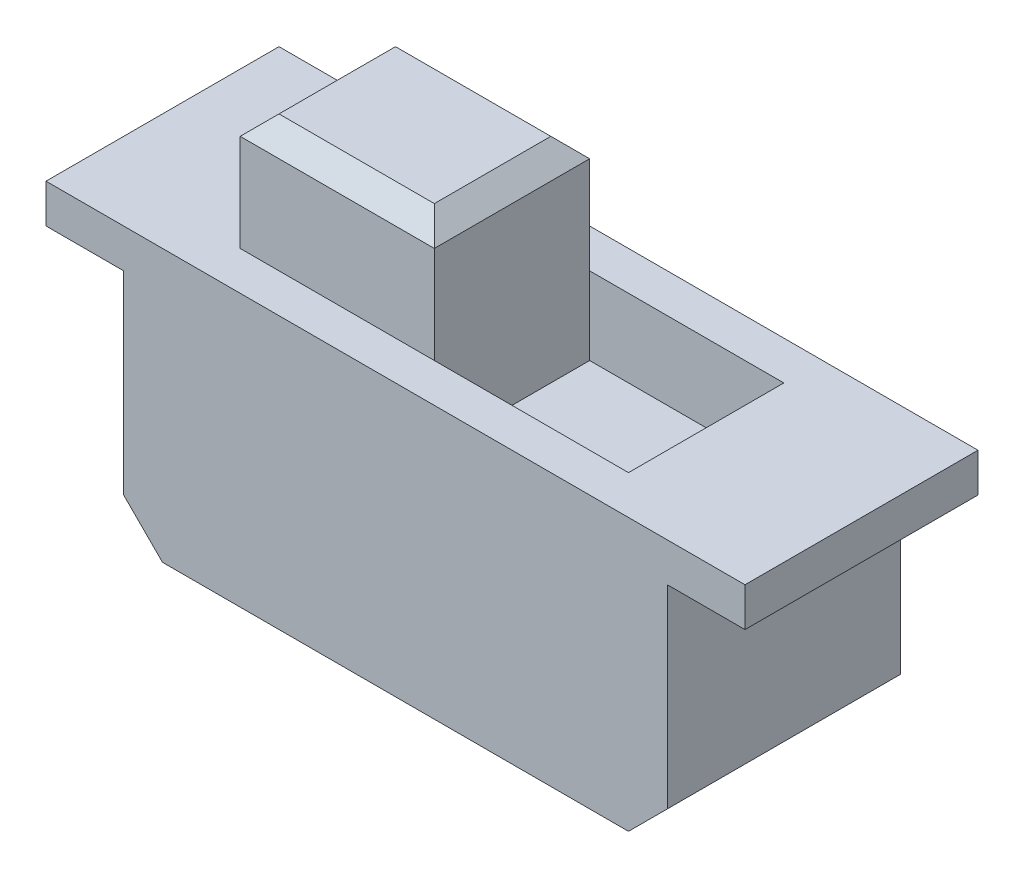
SolidWorks part; units mm, degrees
ref_plane "Plan de face" through (0, 0, 0) normal (0, 0, 1) x (1, 0, 0)
ref_plane "Plan de dessus" through (0, 0, 0) normal (0, 1, 0) x (1, 0, 0)
ref_plane "Plan de droite" through (0, 0, 0) normal (1, 0, 0) x (0, 0, -1)
sketch "Esquisse1" plane through (0, 0, 0) normal (0, 0, 1) x (1, 0, 0)
  line L0 (-9, 0) -> (9, 0)
  line L1 (9, 0) -> (9, -1)
  line L2 (9, -1) -> (7, -1)
  line L3 (7, -1) -> (7, -6)
  line L4 (7, -6) -> (6, -7)
  line L5 (6, -7) -> (-6, -7)
  line L6 (-6, -7) -> (-7, -6)
  line L7 (-7, -6) -> (-7, -1)
  line L8 (-7, -1) -> (-9, -1)
  line L9 (-9, -1) -> (-9, 0)
  dimension "D1" = 12
  dimension "D2" = 5
  dimension "D3" = 1
  dimension "D4" = 2
  dimension "D5" = 18
  dimension "D6" = 45
extrude "Extrusion1" add sketch "Esquisse1" along normal blind 6
sketch "Esquisse2" plane through (0, 0, 0) normal (0, 1, 0) x (-1, 0, 0)
  line L0 (-9, 0) -> (9, 0) construction
  line L1 (5, 1) -> (-5, 1)
  line L2 (5, 1) -> (5, 5)
  line L3 (5, 5) -> (-5, 5)
  line L4 (-5, 1) -> (-5, 5)
  line L5 (-9, 6) -> (9, 6) construction
  line L6 (9, 6) -> (9, 0) construction
  line L7 (-9, 6) -> (-9, 0) construction
  dimension "D1" = 1
  dimension "D2" = 1
  dimension "D3" = 4
  dimension "D4" = 4
extrude "Enlèv. mat.-Extru.1" cut sketch "Esquisse2" against normal blind 2
sketch "Esquisse3" plane through (0, -2, 0) normal (0, 1, 0) x (-1, 0, 0)
  line L0 (-5, 1) -> (5, 1) construction
  line L1 (5, 5) -> (0, 5)
  line L2 (5, 5) -> (5, 1)
  line L3 (5, 1) -> (0, 1)
  line L4 (0, 5) -> (0, 1)
extrude "Extrusion2" add sketch "Esquisse3" along normal blind 5
chamfer "Chanfrein1" distance 0.5 angle 45 4 edges at (-2.5, 3, 1) (0, 3, 3) (-2.5, 3, 5) (-5, 3, 3)
